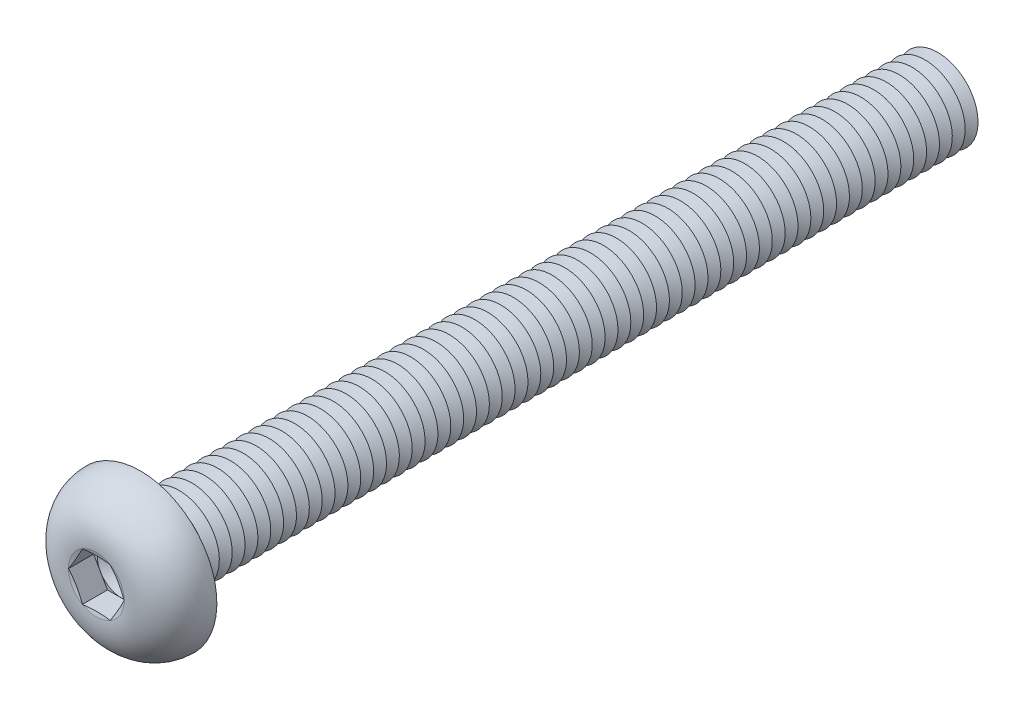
SolidWorks part; units mm, degrees
ref_plane "Front Plane" through (0, 0, 0) normal (0, 0, 1) x (1, 0, 0)
ref_plane "Top Plane" through (0, 0, 0) normal (0, 1, 0) x (1, 0, 0)
ref_plane "Right Plane" through (0, 0, 0) normal (1, 0, 0) x (0, 0, -1)
sketch "Sketch1" plane through (0, 0, 0) normal (1, 0, 0) x (0, 0, -1)
  line L0 (0, 2.5) -> (0, 4.75)
  line L3 (0, 2.5) -> (50, 2.5)
  line L4 (50, 2.5) -> (50, 0)
  line L5 (50, 0) -> (-2.75, 0) construction
  line L6 (-2.75, 0) -> (50, 0)
  line L7 (-2.75, 1.732) -> (-2.75, 0.866) construction
  line L8 (-2.75, 0.866) -> (-2.75, 0)
  line L9 (-2.75, 1.732) -> (-2.5179, 0.866)
  line L10 (-2.5179, 0.866) -> (-2.75, 0.866)
  line L11 (50, 0) -> (22.7481, 0) construction
  line L12 (0, 4.75) -> (-2.75, 4.75) construction
  arc A1 (0, 4.75) -> (-2.75, 1.732) centre (0, 1.9881) ccw
  point P8 (50, 1.25)
  dimension "D1" = 9.5
  dimension "D2" = 5
  dimension "D3" = 2.75
  dimension "D4" = 3.4641
  dimension "D5" = 50
  dimension "D6" = 15
revolve "Revolve1" add sketch "Sketch1" angle 360 about L5
fillet "Fillet1" radius 0.4 1 edges at (0, 2.5, 0)
sketch "Sketch2" plane through (0, 0, 0) normal (1, 0, 0) x (0, 0, -1)
  line L0 (49.6, 2.5) -> (50.4, 2.5)
  line L1 (50, 2.5) -> (0.4, 2.5) construction
  line L2 (50.4, 2.5) -> (50, 1.8072)
  line L3 (50, -2.5) -> (50, 2.5) construction
  line L4 (50, 1.8072) -> (49.6, 2.5)
  dimension "D1" = 0.8
revolve "Cut-Revolve1" cut sketch "Sketch2" angle 360 about axis through (0, 0, -50) along (0, 0, -1)
pattern_linear "LPattern1" count 62 spacing 0.8 along (0, 0, 1) of "Cut-Revolve1"
sketch "Sketch3" plane through (0, 0, 2.75) normal (0, 0, 1) x (1, 0, 0)
  line L7 (0.866, 1.5) -> (-0.866, 1.5)
  line L8 (-0.866, 1.5) -> (-1.7321, 0)
  line L9 (-1.7321, 0) -> (-0.866, -1.5)
  line L10 (-0.866, -1.5) -> (0.866, -1.5)
  line L11 (0.866, -1.5) -> (1.7321, 0)
  line L12 (1.7321, 0) -> (0.866, 1.5)
  circle A0 centre (0, 0) radius 1.5 construction
  circle A3 centre (0, 0) radius 1.732 construction
extrude "Cut-Extrude1" cut sketch "Sketch3" against normal blind 1.56
sketch "Sketch4" plane through (0, 0, 1.19) normal (0, 0, 1) x (1, 0, 0)
  line L1 (0.866, 1.5) -> (-0.866, 1.5) construction
  circle A0 centre (0, 0) radius 1.5
extrude "Cut-Extrude2" cut sketch "Sketch4" against normal through all draft 60
